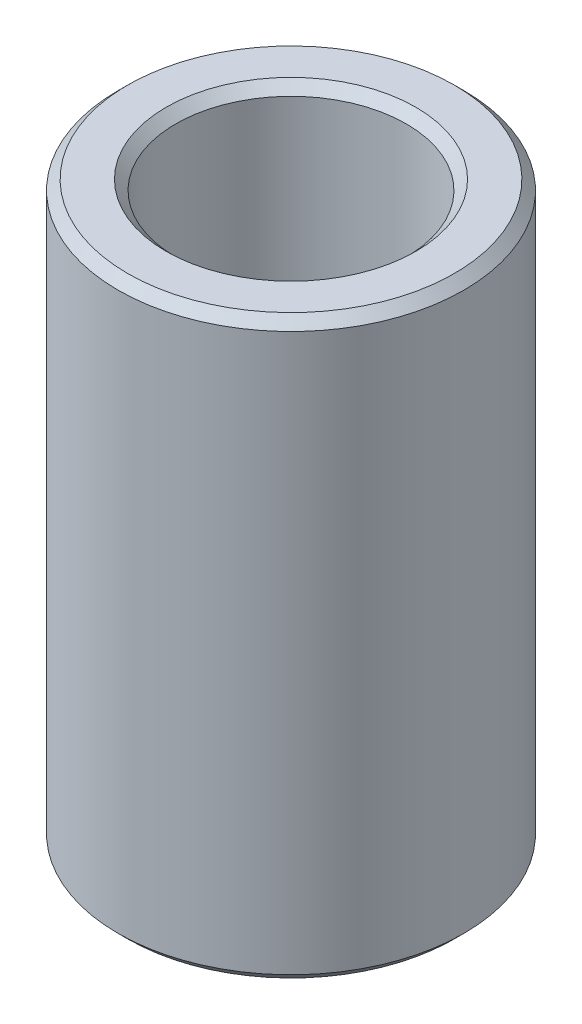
SolidWorks part; units mm, degrees
ref_plane "Front" through (0, 0, 0) normal (0, 0, 1) x (1, 0, 0)
ref_plane "Top" through (0, 0, 0) normal (0, 1, 0) x (1, 0, 0)
ref_plane "Right" through (0, 0, 0) normal (1, 0, 0) x (0, 0, -1)
sketch "Sketch1" plane through (0, 0, 0) normal (0, 1, 0) x (1, 0, 0)
  circle A0 centre (0, 0) radius 4.5
extrude "Extrude1" add sketch "Sketch1" along normal blind 15
sketch "Sketch2" plane through (0, 15, 0) normal (0, 1, 0) x (-1, 0, 0)
  circle A0 centre (0, 0) radius 3
extrude "Cut-Extrude1" cut sketch "Sketch2" against normal blind 15
chamfer "Chamfer1" distance 0.25 angle 45 4 edges at (0, 0, 4.5) (0, 15, 4.5) (0, 0, 3) (0, 15, 3)
